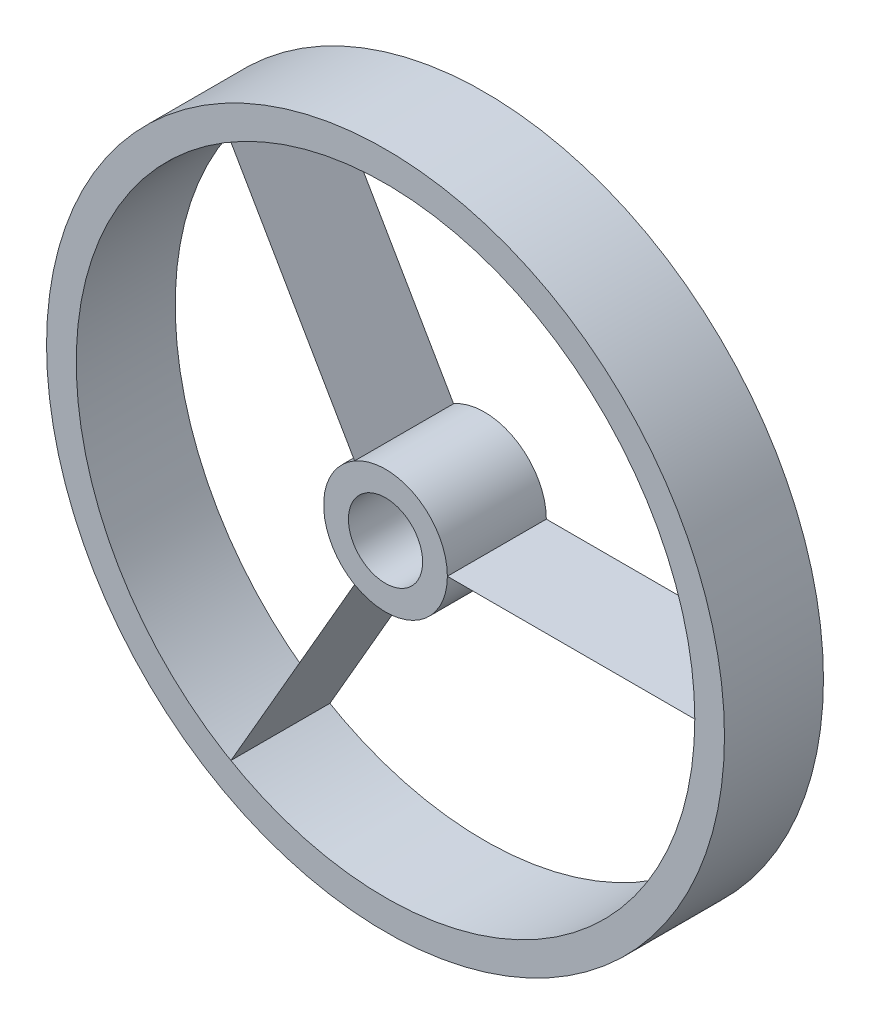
SolidWorks part; units mm, degrees
ref_plane "Front" through (0, 0, 0) normal (0, 0, 1) x (1, 0, 0)
ref_plane "Top" through (0, 0, 0) normal (0, 1, 0) x (1, 0, 0)
ref_plane "Right" through (0, 0, 0) normal (1, 0, 0) x (0, 0, -1)
sketch "Sketch4" plane through (0, 0, 0) normal (0, 0, 1) x (1, 0, 0)
  circle A0 centre (0, 0) radius 25
  dimension "D1" = 50
extrude "Extrude2" add sketch "Sketch4" along normal blind 40 separate body
sketch "Sketch13" plane through (0, 0, 40) normal (0, 0, 1) x (1, 0, 0)
  circle A0 centre (0, 0) radius 15
  dimension "D1" = 30
extrude "Extrude6" cut sketch "Sketch13" against normal through all
sketch "Sketch5" plane through (0, 0, 0) normal (0, 0, 1) x (1, 0, 0)
  line L0 (0, 0) -> (167.4564, 0) construction
  line L1 (25, 0) -> (125, 0)
  circle A0 centre (0, 0) radius 25 construction
  circle A3 centre (0, 0) radius 125 construction
  dimension "D1" = 250
extrude "Extrude-Thin1" add sketch "Sketch5" along normal through all separate body thin
sketch "Sketch15" plane through (0, 0, 0) normal (0, 0, 1) x (1, 0, 0)
  line L0 (-12.5, 21.6506) -> (-62.5, 108.2532)
  line L1 (0, 0) -> (167.4564, 0) construction
  circle A0 centre (0, 0) radius 125 construction
  circle A1 centre (0, 0) radius 25 construction
  circle A2 centre (0, 0) radius 25 construction
  dimension "D1" = 120
extrude "Extrude-Thin7" add sketch "Sketch15" along normal through all separate body thin
sketch "Sketch16" plane through (0, 0, 0) normal (0, 0, 1) x (1, 0, 0)
  line L0 (-12.5, -21.6506) -> (-62.5, -108.2532)
  line L1 (0, 0) -> (167.4564, 0) construction
  circle A0 centre (0, 0) radius 125 construction
  circle A1 centre (0, 0) radius 25 construction
  circle A2 centre (0, 0) radius 25 construction
  dimension "D1" = 120
extrude "Extrude-Thin8" add sketch "Sketch16" along normal through all separate body thin
sketch "Sketch18" plane through (0, 0, 0) normal (0, 0, 1) x (1, 0, 0)
  circle A0 centre (0, 0) radius 125 construction
  circle A1 centre (0, 0) radius 125
extrude "Extrude-Thin10" add sketch "Sketch18" along normal through all separate body thin
surface "Surface-MidSurface1" parameters "D0"=50000
surface "Surface-MidSurface2" parameters "D0"=50000
surface "Surface-MidSurface3" parameters "D0"=50000
delete or keep bodies "Body-Delete1" type delete bodies bodies 106 131 132
